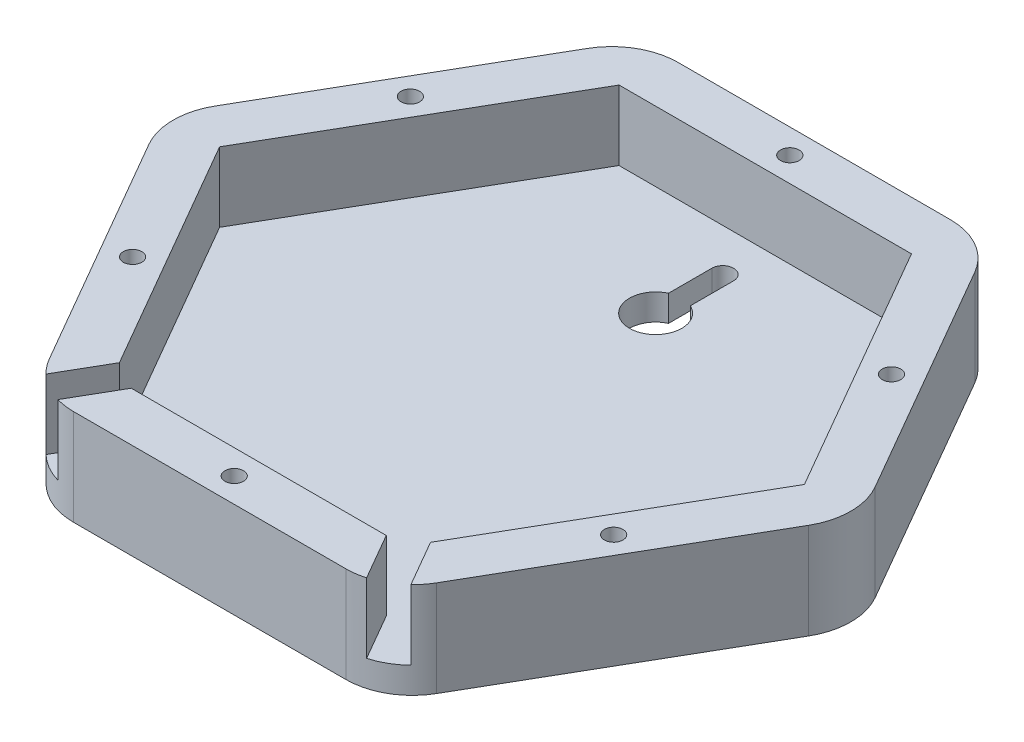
SolidWorks part; units mm, degrees
ref_plane "Front Plane" through (0, 0, 0) normal (0, 0, 1) x (1, 0, 0)
ref_plane "Top Plane" through (0, 0, 0) normal (0, 1, 0) x (1, 0, 0)
ref_plane "Right Plane" through (0, 0, 0) normal (1, 0, 0) x (0, 0, -1)
sketch "Sketch1" plane through (0, 0, 0) normal (0, 1, 0) x (1, 0, 0)
  line L0 (-40.043, 69.3564) -> (40.043, 69.3564)
  line L1 (80.0859, 0) -> (40.043, 69.3564)
  line L2 (-2.5, 48.3389) -> (-2.5, 38.4021)
  line L3 (-40.043, 69.3564) -> (-80.0859, 0)
  line L4 (-80.0859, 0) -> (-40.043, -69.3564)
  line L5 (-40.043, -69.3564) -> (40.043, -69.3564)
  line L6 (40.043, -69.3564) -> (80.0859, 0)
  line L7 (40.043, 69.3564) -> (-40.043, 69.3564)
  line L8 (2.5, 48.3389) -> (2.5, 38.4021)
  circle A0 centre (0, 0) radius 69.3564 construction
  arc A1 (-2.5, 38.4021) -> (2.5, 38.4021) centre (0, 32.9477) ccw
  arc A2 (2.5, 48.3389) -> (-2.5, 48.3389) centre (0, 48.3389) ccw
extrude "Boss-Extrude1" add sketch "Sketch1" along normal blind 6
sketch "Sketch2" plane through (0, 6, 0) normal (0, 1, 0) x (1, 0, 0)
  line L1 (80.0859, 0) -> (40.043, 69.3564)
  line L2 (40.043, 69.3564) -> (-40.043, 69.3564)
  line L3 (-40.043, 69.3564) -> (-80.0859, 0)
  line L4 (-80.0859, 0) -> (-40.043, -69.3564)
  line L5 (-40.043, -69.3564) -> (40.043, -69.3564)
  line L6 (40.043, -69.3564) -> (80.0859, 0)
  line L8 (67.0859, 0) -> (33.543, 58.0981)
  line L9 (33.543, 58.0981) -> (-33.543, 58.0981)
  line L10 (-33.543, 58.0981) -> (-67.0859, 0)
  line L11 (-67.0859, 0) -> (-33.543, -58.0981)
  line L12 (-33.543, -58.0981) -> (33.543, -58.0981)
  line L13 (33.543, -58.0981) -> (67.0859, 0)
  circle A0 centre (0, 0) radius 69.3564 construction
  circle A1 centre (0, 0) radius 58.0981 construction
extrude "Boss-Extrude2" add sketch "Sketch2" along normal blind 16
sketch "Sketch3" plane through (0, 22, 0) normal (0, 1, 0) x (1, 0, 0)
  circle A1 centre (0, 63.7273) radius 2.125
  circle A2 centre (55.1894, 31.8636) radius 2.125
  circle A3 centre (55.1894, -31.8636) radius 2.125
  circle A4 centre (0, -63.7273) radius 2.125
  circle A5 centre (-55.1894, -31.8636) radius 2.125
  circle A6 centre (-55.1894, 31.8636) radius 2.125
  point P26 (0, 0)
  point P28 (0, 0)
  dimension "D1" = 6
extrude "Cut-Extrude1" cut sketch "Sketch3" against normal through all
fillet "Fillet1" radius 15.24 6 edges at (40.043, 11, 69.3564) (-40.043, 11, 69.3564) (-80.0859, 11, 0) (80.0859, 11, 0) (40.043, 11, -69.3564) (-40.043, 11, -69.3564)
sketch "Sketch21" plane through (0, 0, 0) normal (0, -1, 0) x (1, 0, 0)
  line L0 (38.4585, -187.5668) -> (362.4585, -187.5668) construction
  line L1 (-11.7029, 10.0555) -> (-24.3592, 10.0555)
  line L2 (-24.3592, 32.4471) -> (-11.7029, 32.4471)
  line L3 (-11.7029, 32.4471) -> (-11.7029, 10.0555)
  line L4 (-17.2466, 19.0046) -> (-22.3694, 19.0046)
  line L5 (-17.2466, 19.0046) -> (-17.2466, 15.5876)
  line L6 (-17.2466, 26.9151) -> (-17.2466, 23.4905)
  line L7 (-11.7029, -15.6289) -> (-25.9398, -15.6289)
  line L8 (-11.7029, 6.6309) -> (-11.7029, -15.6289)
  line L9 (-17.2466, -10.2286) -> (-22.6029, -10.2286)
  line L10 (-17.2466, -6.8238) -> (-17.2466, -10.2286)
  line L11 (-17.2466, -2.194) -> (-23.7007, -2.0623)
  line L12 (-17.2466, 1.0989) -> (-17.2466, -2.194)
  line L13 (5.4084, 10.0555) -> (-2.3628, 10.0555)
  line L14 (-2.3628, 10.0555) -> (-9.212, 32.4471)
  line L15 (-9.212, 32.4471) -> (-3.0214, 32.4471)
  line L16 (-3.0214, 32.4471) -> (-1.565, 27.0468)
  line L17 (-1.565, 27.0468) -> (4.6181, 27.0468)
  line L18 (4.6181, 27.0468) -> (6.067, 32.4471)
  line L19 (6.067, 32.4471) -> (12.2576, 32.4471)
  line L20 (12.2576, 32.4471) -> (5.4084, 10.0555)
  line L21 (1.5158, 15.7193) -> (-0.1455, 21.6595)
  line L22 (-0.1455, 21.6595) -> (3.1693, 21.6595)
  line L23 (3.1693, 21.6595) -> (1.5158, 15.7193)
  line L24 (5.5401, -15.7607) -> (-2.3628, -15.6289)
  line L25 (-2.3628, -15.6289) -> (-9.212, 6.6309)
  line L26 (-9.212, 6.6309) -> (-3.0214, 6.6309)
  line L27 (-3.0214, 6.6309) -> (-1.565, 1.2343)
  line L28 (-1.565, 1.2343) -> (4.6181, 1.2343)
  line L29 (4.6181, 1.2343) -> (6.067, 6.6309)
  line L30 (6.067, 6.6309) -> (12.2576, 6.6309)
  line L31 (12.2576, 6.6309) -> (5.5401, -15.7607)
  line L32 (1.5887, -10.0969) -> (-0.1455, -4.1918)
  line L33 (-0.1455, -4.1918) -> (3.1384, -4.1918)
  line L34 (3.1384, -4.1918) -> (1.5887, -10.0969)
  line L35 (30.0392, -15.6289) -> (13.8382, -15.6289)
  line L36 (13.8382, -15.6289) -> (13.8382, -10.2286)
  line L37 (13.8382, -10.2286) -> (30.0392, -10.2286)
  line L38 (30.0392, -10.2286) -> (30.0392, -15.6289)
  line L39 (30.0392, -7.726) -> (13.8382, -7.726)
  line L40 (13.8382, -7.726) -> (13.8382, -2.194)
  line L41 (13.8382, -2.194) -> (23.5851, -2.194)
  line L42 (23.5851, -2.194) -> (23.5851, 6.6309)
  line L43 (23.5851, 6.6309) -> (30.0392, 6.6309)
  line L44 (30.0392, 6.6309) -> (30.0392, -7.726)
  line L45 (30.0392, 10.0555) -> (23.5851, 10.0555)
  line L46 (23.5851, 10.0555) -> (23.5851, 26.9151)
  line L47 (23.5851, 26.9151) -> (13.8382, 26.9151)
  line L48 (13.8382, 26.9151) -> (13.8382, 32.4471)
  line L49 (13.8382, 32.4471) -> (30.0392, 32.4471)
  line L50 (30.0392, 32.4471) -> (30.0392, 10.0555)
  line L51 (29.9015, 34.818) -> (27.9317, 34.818)
  line L52 (27.9317, 34.818) -> (27.9317, 37.886)
  line L53 (23.3537, 34.9766) -> (25.956, 38.1109)
  line L54 (25.956, 38.1109) -> (23.0583, 41.9306)
  line L55 (25.8243, 41.9306) -> (27.6558, 39.4129)
  line L56 (27.9317, 42.0624) -> (29.9015, 42.0624)
  line L57 (29.9015, 42.0624) -> (29.9015, 34.818)
  line L58 (22.2796, 34.818) -> (20.2922, 34.818)
  line L59 (20.2922, 34.818) -> (20.2922, 37.4461)
  line L60 (20.2922, 37.4461) -> (17.6579, 37.4461)
  line L61 (17.6579, 37.4461) -> (17.6579, 34.818)
  line L62 (17.6579, 34.818) -> (15.6822, 34.818)
  line L63 (15.6822, 34.818) -> (15.6822, 42.0624)
  line L64 (15.6822, 42.0624) -> (17.6579, 42.0624)
  line L65 (17.6579, 42.0624) -> (17.6579, 38.9012)
  line L66 (17.6579, 38.9012) -> (20.2922, 38.9012)
  line L67 (20.2922, 38.9012) -> (20.2922, 42.0624)
  line L68 (20.2922, 42.0624) -> (22.2796, 42.0624)
  line L69 (22.2796, 42.0624) -> (22.2796, 34.818)
  line L70 (6.4621, 34.818) -> (2.1155, 34.818)
  line L71 (2.1155, 34.818) -> (2.1155, 36.1352)
  line L72 (2.1155, 36.1352) -> (3.3113, 36.1352)
  line L73 (3.3113, 36.1352) -> (3.3113, 40.7452)
  line L74 (3.3113, 40.7452) -> (2.1155, 40.7452)
  line L75 (2.1155, 40.7452) -> (2.1155, 42.0624)
  line L76 (2.1155, 42.0624) -> (6.4621, 42.0624)
  line L77 (6.4621, 42.0624) -> (6.4621, 40.7452)
  line L78 (6.4621, 40.7452) -> (5.259, 40.7452)
  line L79 (5.259, 40.7452) -> (5.259, 36.1352)
  line L80 (5.259, 36.1352) -> (6.4621, 36.1352)
  line L81 (6.4621, 36.1352) -> (6.4621, 34.818)
  line L82 (12.1294, 34.818) -> (9.755, 34.818)
  line L83 (9.755, 34.818) -> (7.1207, 42.0624)
  line L84 (7.1207, 42.0624) -> (9.2322, 42.0624)
  line L85 (9.2322, 42.0624) -> (9.6751, 40.6135)
  line L86 (9.6751, 40.6135) -> (12.2576, 40.6135)
  line L87 (12.2576, 40.6135) -> (12.6681, 42.0624)
  line L88 (12.6681, 42.0624) -> (14.8231, 42.0624)
  line L89 (14.8231, 42.0624) -> (12.1294, 34.818)
  line L90 (10.9587, 37.0572) -> (10.166, 39.1745)
  line L91 (10.166, 39.1745) -> (11.7463, 39.1745)
  line L92 (11.7463, 39.1745) -> (10.9587, 37.0572)
  line L93 (-3.8888, 38.9012) -> (-6.3142, 42.0624)
  line L94 (-6.3142, 42.0624) -> (-3.8888, 42.0624)
  line L95 (-6.9915, 34.818) -> (-11.292, 34.818)
  line L96 (-1.1774, 39.428) -> (-1.1774, 42.0624)
  line L97 (-1.1774, 42.0624) -> (0.7725, 42.0624)
  line L98 (0.7725, 42.0624) -> (0.7725, 34.818)
  line L99 (-8.9461, 39.8325) -> (-10.1452, 39.8325)
  line L100 (-1.1774, 37.9792) -> (-1.1774, 36.2669)
  line L101 (-8.9461, 39.8325) -> (-8.9461, 42.0624)
  line L102 (-8.9461, 42.0624) -> (-6.9915, 42.0624)
  line L103 (-6.9915, 42.0624) -> (-6.9915, 34.818)
  line L104 (-8.9461, 38.2417) -> (-8.9486, 36.2669)
  line L105 (-14.2005, 34.818) -> (-16.1857, 34.818)
  line L106 (-18.8233, 34.8289) -> (-20.821, 34.8289)
  line L107 (-27.1222, 38.9012) -> (-29.5543, 42.0624)
  line L108 (-26.9365, 42.0624) -> (-25.1038, 39.428)
  line L109 (-24.3592, 39.428) -> (-24.3592, 42.0624)
  line L110 (-24.3592, 42.0624) -> (-22.3694, 42.0624)
  line L111 (-22.3694, 42.0624) -> (-22.3694, 34.8289)
  line L112 (-24.3592, 36.2669) -> (-25.6921, 36.2669)
  line L113 (-25.6555, 37.9792) -> (-24.3592, 37.9792)
  line L114 (-24.3592, 37.9792) -> (-24.3592, 36.2669)
  line L115 (-26.9365, 42.0624) -> (-29.5543, 42.0624)
  line L116 (-24.3592, 39.428) -> (-25.1038, 39.428)
  line L117 (-22.3694, 34.8289) -> (-26.9365, 34.8289)
  line L118 (-17.2466, 15.5876) -> (-22.3694, 15.5876)
  line L119 (-17.2466, 26.9151) -> (-22.7977, 26.9151)
  line L120 (-17.2466, 23.4905) -> (-22.7977, 23.4905)
  line L121 (-8.9461, 38.2417) -> (-10.3658, 38.2417)
  line L122 (-8.9486, 36.2669) -> (-10.3658, 36.2669)
  line L123 (0.7725, 34.818) -> (-3.7771, 34.818)
  line L124 (-1.1774, 39.428) -> (-1.9262, 39.428)
  line L125 (-1.9262, 39.428) -> (-3.8888, 42.0624)
  line L126 (-1.1774, 37.9792) -> (-2.727, 37.9792)
  line L127 (-1.1774, 36.2669) -> (-2.727, 36.2669)
  line L128 (-20.821, 34.8289) -> (-20.821, 39.9564)
  line L129 (-18.8233, 34.8289) -> (-18.8233, 39.5843)
  line L130 (-16.1857, 34.818) -> (-16.1857, 39.5843)
  line L131 (-14.2005, 34.818) -> (-14.2005, 39.9564)
  arc A0 (-25.6921, 36.2669) -> (-25.6555, 37.9792) centre (-25.6921, 37.1234) cw
  arc A1 (-18.8233, 39.5843) -> (-16.1857, 39.5843) centre (-17.5045, 39.5843) cw
  spline S0 degree 3 poles (-24.3592, 10.0555) (-27.3609, 9.5754) (-30.558, 14.1296) (-29.7733, 19.5479) (-26.9365, 20.6468) knots 0 0 0 0 0.496597 1 1 1 1
  spline S1 degree 3 poles (-24.3592, 32.4471) (-27.6946, 33.114) (-30.6763, 29.3926) (-30.6888, 23.5851) (-28.7926, 20.9116) (-26.9365, 20.6468) knots 0 0 0 0 0.489367 0.697723 1 1 1 1
  spline S2 degree 2 poles (-22.3694, 15.5876) (-24.2788, 17.1692) (-22.3694, 19.0046) knots 0 0 0 1 1 1
  spline S3 degree 2 poles (-22.7977, 26.9151) (-25.6322, 25.2711) (-22.7977, 23.4905) knots 0 0 0 1 1 1
  spline S4 degree 2 poles (-10.3658, 36.2669) (-11.8183, 37.2543) (-10.3658, 38.2417) knots 0 0 0 1 1 1
  spline S5 degree 3 poles (-20.821, 39.9564) (-20.5422, 41.5761) (-17.5578, 43.0953) (-14.3451, 41.5831) (-14.2005, 39.9564) knots 0 0 0 0 0.499382 1 1 1 1
  spline S6 degree 3 poles (-25.9398, -15.6289) (-25.9838, -15.5851) (-26.0129, -15.517) (-26.0718, -15.4975) (-26.7715, -15.2658) (-27.4546, -15.2044) (-28.0491, -14.711) (-28.3605, -14.4525) (-28.6101, -14.1229) (-28.8411, -13.7906) (-29.2137, -13.2547) (-29.452, -12.5985) (-29.5033, -11.9478) (-29.5584, -11.249) (-30.1335, -7.5656) (-28.9872, -6.4148) (-28.6367, -6.0629) (-28.3165, -5.6778) (-27.9355, -5.359) (-27.7849, -5.233) (-27.5846, -5.1827) (-27.4092, -5.0946) knots 0 0 0 0 1 1 1 2 2 2 3 3 3 4 4 4 5 5 5 6 6 6 7 7 7 7
  spline S7 degree 3 poles (-27.4092, -5.0946) (-28.749, -4.4993) (-29.606, -4.1851) (-30.1954, -2.7474) (-30.4338, -2.1657) (-30.6009, -1.5354) (-30.6062, -0.9068) (-30.626, 1.406) (-30.8733, 3.5667) (-29.0775, 5.1654) (-28.2585, 5.8944) (-26.7146, 6.4571) (-25.6642, 6.5117) (-23.9099, 6.603) (-22.1536, 6.6734) (-20.3969, 6.6884) (-17.499, 6.7132) (-14.6009, 6.6501) (-11.7029, 6.6309) knots 0 0 0 0 1 1 1 2 2 2 3 3 3 4 4 4 5 5 5 6 6 6 6
  spline S8 degree 3 poles (-22.6029, -10.2286) (-22.7483, -9.9724) (-22.9957, -9.7514) (-23.0389, -9.4601) (-23.1358, -8.8072) (-23.0202, -8.1402) (-23.0108, -7.4802) knots 0 0 0 0 1 1 1 2 2 2 2
  spline S9 degree 3 poles (-23.0108, -7.4802) (-22.7569, -7.3309) (-22.5418, -7.0656) (-22.2492, -7.0323) (-20.5909, -6.8435) (-18.9141, -6.8933) (-17.2466, -6.8238) knots 0 0 0 0 1 1 1 2 2 2 2
  spline S10 degree 3 poles (-23.7007, -2.0623) (-23.7885, -1.8866) (-23.9077, -1.7235) (-23.9641, -1.5354) (-24.0408, -1.2796) (-24.0958, -1.0122) (-24.0958, -0.7451) (-24.0958, -0.3039) (-24.1225, 0.1602) (-23.9641, 0.572) (-23.8853, 0.7769) (-23.6561, 0.95) (-23.4372, 0.9672) (-21.3795, 1.1286) (-19.3102, 1.055) (-17.2466, 1.0989) knots 0 0 0 0 1 1 1 2 2 2 3 3 3 4 4 4 5 5 5 5
  spline S11 degree 3 poles (27.9317, 37.886) (27.2401, 37.1076) (26.726, 36.2277) (26.0993, 35.4027) (25.9866, 35.2544) (25.9122, 35.0135) (25.7282, 34.985) (24.946, 34.8636) (24.1452, 34.9794) (23.3537, 34.9766) knots 0 0 0 0 1 1 1 2 2 2 3 3 3 3
  spline S12 degree 3 poles (23.0583, 41.9306) (23.1022, 41.9745) (23.1279, 42.0624) (23.19, 42.0624) (24.0692, 42.0624) (24.9462, 41.9745) (25.8243, 41.9306) knots 0 0 0 0 1 1 1 2 2 2 2
  spline S13 degree 3 poles (27.6558, 39.4129) (27.7395, 39.5046) (27.8942, 39.5644) (27.9071, 39.688) (27.9891, 40.4752) (27.9235, 41.2709) (27.9317, 42.0624) knots 0 0 0 0 1 1 1 2 2 2 2
  spline S14 degree 2 poles (-2.727, 37.9792) (-3.8503, 37.123) (-2.727, 36.2669) knots 0 0 0 1 1 1
  spline S15 degree 3 poles (-3.8888, 38.9012) (-4.8729, 38.7399) (-5.8784, 36.8284) (-4.7176, 35.0479) (-3.7771, 34.818) knots 0 0 0 0 0.493152 1 1 1 1
  spline S16 degree 3 poles (-11.292, 34.818) (-12.313, 35.0238) (-13.7484, 36.7116) (-12.3603, 39.3838) (-11.3228, 39.6893) (-10.1452, 39.8325) knots 0 0 0 0 0.415105 0.684406 1 1 1 1
  spline S24 degree 2 poles (-27.1222, 38.9012) (-29.8855, 36.7919) (-26.9365, 34.8289) knots 0 0 0 1 1 1
extrude "Cut-Extrude2" cut sketch "Sketch21" against normal blind 2
sketch "Sketch22" plane through (0, 22, 0) normal (0, 1, 0) x (1, 0, 0)
  line L31 (44.8437, -70.2365) -> (38.4048, -73.9541)
  line L32 (44.8437, -70.2365) -> (19.6933, -26.6748)
  line L33 (19.6933, -26.6748) -> (13.2544, -30.3923)
  line L34 (38.4048, -73.9541) -> (13.2544, -30.3923)
  line L35 (44.8437, -70.2365) -> (13.2544, -30.3923) construction
  line L36 (19.6933, -26.6748) -> (38.4048, -73.9541) construction
  line L43 (-38.4048, -73.9541) -> (-44.8437, -70.2365)
  line L44 (-38.4048, -73.9541) -> (-13.2544, -30.3923)
  line L45 (-13.2544, -30.3923) -> (-19.6933, -26.6748)
  line L46 (-44.8437, -70.2365) -> (-19.6933, -26.6748)
  line L47 (-38.4048, -73.9541) -> (-19.6933, -26.6748) construction
  line L48 (-13.2544, -30.3923) -> (-44.8437, -70.2365) construction
extrude "Cut-Extrude3" cut sketch "Sketch22" against normal blind 16
